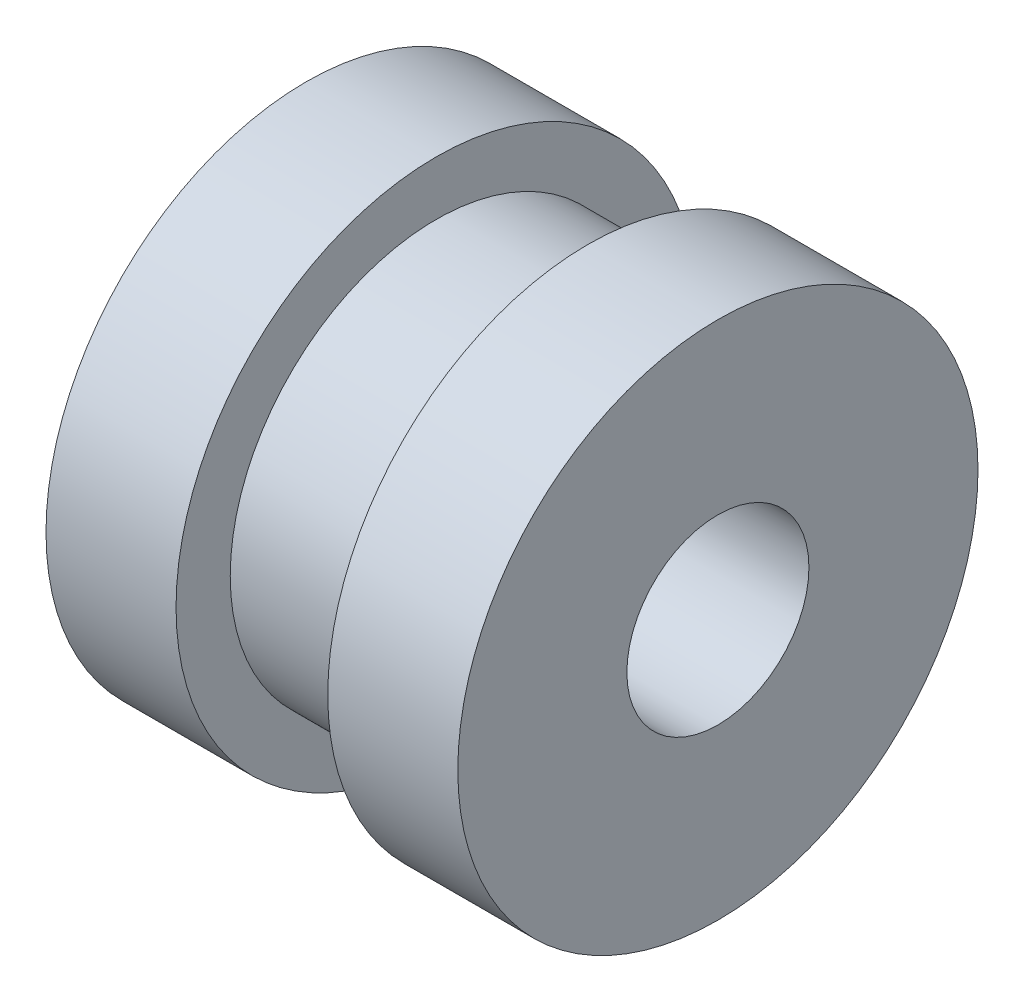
SolidWorks part; units mm, degrees
ref_plane "Front" through (0, 0, 0) normal (0, 0, 1) x (1, 0, 0)
ref_plane "Top" through (0, 0, 0) normal (0, 1, 0) x (1, 0, 0)
ref_plane "Right" through (0, 0, 0) normal (1, 0, 0) x (0, 0, -1)
sketch "Sketch1" plane through (0, 0, 0) normal (0, 1, 0) x (1, 0, 0)
  line L0 (6.5, 4.75) -> (6.5, 6)
  line L1 (0, 0) -> (9.5, 0)
  line L2 (0, 0) -> (0, 6)
  line L3 (0, 6) -> (3, 6)
  line L4 (9.5, 0) -> (9.5, 6)
  line L5 (3, 4.75) -> (3, 6)
  line L6 (3, 4.75) -> (6.5, 4.75)
  line L7 (6.5, 6) -> (9.5, 6)
  line L8 (0, 6) -> (9.5, 6) construction
  line L9 (0, 4.75) -> (9.5, 4.75) construction
  line L10 (6.5, 0) -> (6.5, 6) construction
  line L11 (3, 0) -> (3, 6) construction
revolve "Revolve1" add sketch "Sketch1" angle 360 about L1
sketch "Sketch2" plane through (9.5, 0, 0) normal (1, 0, 0) x (0, 0, -1)
  point P0 (0, 0)
hole_wizard "M5 Tapped Hole1" positions "3DSketch1" profile "Sketch4" tap size "M5" standard "ISO"
sketch3d "3DSketch1"
  point P0 (9.5, 0, 0)
sketch "Sketch4" plane through (9.5, 0, 0) normal (0, 1, 0) x (0, 0, -1)
  line L0 (0, 0) -> (0, 9.5)
  line L1 (0, 9.5) -> (2.1, 9.5)
  line L2 (2.1, 9.5) -> (2.1, 0)
  line L5 (2.1, 0) -> (0, 0)
  line L11 (0, -6.35) -> (0, 107.95) construction
  dimension "Thru Tap Drill Dia." = 4.2
  dimension "Thru Tap Drill Depth" = 9.5
